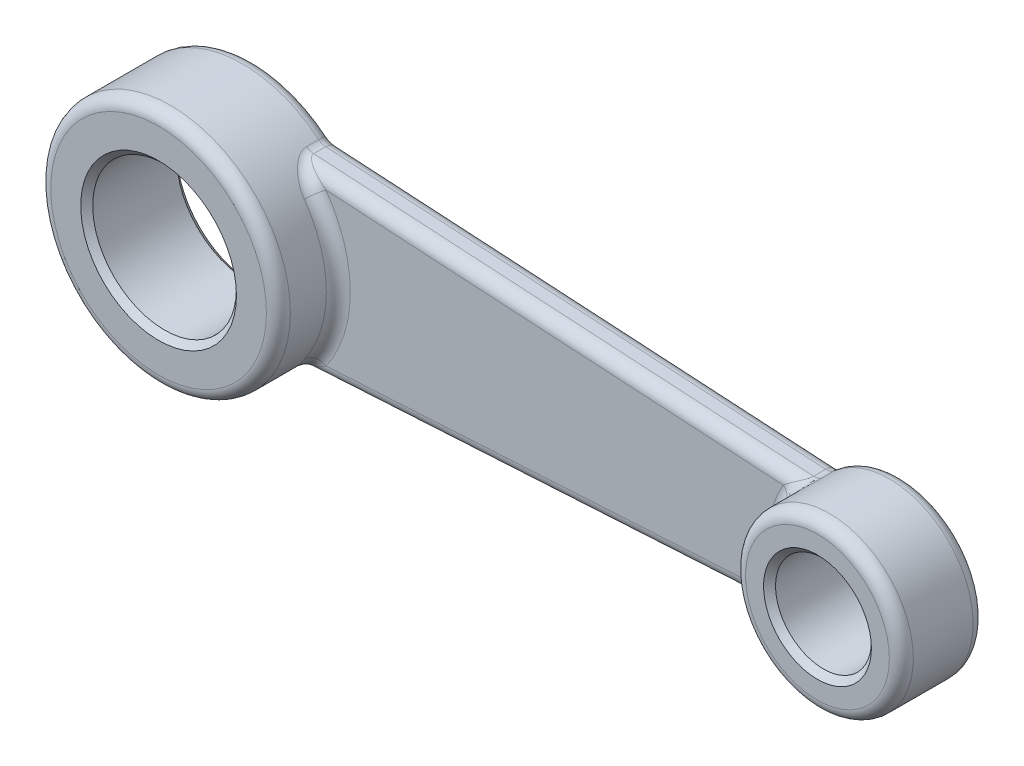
SolidWorks part; units mm, degrees
ref_plane "Front" through (0, 0, 0) normal (0, 0, 1) x (1, 0, 0)
ref_plane "Top" through (0, 0, 0) normal (0, 1, 0) x (1, 0, 0)
ref_plane "Right" through (0, 0, 0) normal (1, 0, 0) x (0, 0, -1)
sketch "Sketch1" plane through (0, 0, 0) normal (0, 0, 1) x (1, 0, 0)
  circle A0 centre (0, 0) radius 31.75
  dimension "D1" = 63.5
extrude "Extrude1" add sketch "Sketch1" along normal blind 25.4
sketch "Sketch2" plane through (0, 0, 0) normal (0, 0, 1) x (1, 0, 0)
  circle A0 centre (171.45, 0) radius 22.225
  dimension "D1" = 44.45
  dimension "D2" = 171.45
extrude "Extrude2" add sketch "Sketch2" along normal blind 22.225 separate body
sketch "Sketch3" plane through (0, 0, 0) normal (0, 0, 1) x (1, 0, 0)
  line L0 (0, 0) -> (171.45, 0) construction
  line L1 (21.0007, 23.8125) -> (21.0007, -23.8125)
  line L2 (155.8957, 15.875) -> (155.8957, -15.875)
  line L3 (21.0007, 23.8125) -> (155.8957, 15.875)
  line L4 (155.8957, -15.875) -> (21.0007, -23.8125)
  circle A0 centre (0, 0) radius 31.75 construction
  circle A1 centre (171.45, 0) radius 22.225 construction
  dimension "D1" = 31.75
  dimension "D2" = 47.625
extrude "Extrude3" add sketch "Sketch3" along normal blind 9.525
sketch "Sketch4" plane through (0, 0, 25.4) normal (0, 0, 1) x (1, 0, 0)
  circle A0 centre (0, 0) radius 19.05
extrude "Cut-Extrude1" cut sketch "Sketch4" against normal through all
sketch "Sketch5" plane through (0, 0, 22.225) normal (0, 0, 1) x (1, 0, 0)
  circle A0 centre (171.45, 0) radius 12.7
extrude "Cut-Extrude2" cut sketch "Sketch5" against normal through all
fillet "Fillet1" radius 3.175 14 edges at (149.225, 0, 9.525) (31.75, 0, 9.525) (31.75, 0, 25.4) (-31.75, 0, 0) (21.0007, 23.8125, 4.7625) (21.0007, -23.8125, 4.7625) (155.8957, -15.875, 4.7625) (155.8957, 15.875, 4.7625) (88.4482, -19.8438, 9.525) (88.4482, 19.8438, 9.525) (88.4482, -19.8438, 0) (88.4482, 19.8438, 0) (193.675, 0, 22.225) (193.675, 0, 0)
chamfer "Chamfer1" distance 1.5875 angle 45 4 edges at (184.15, 0, 22.225) (184.15, 0, 0) (19.05, 0, 25.4) (19.05, 0, 0)
